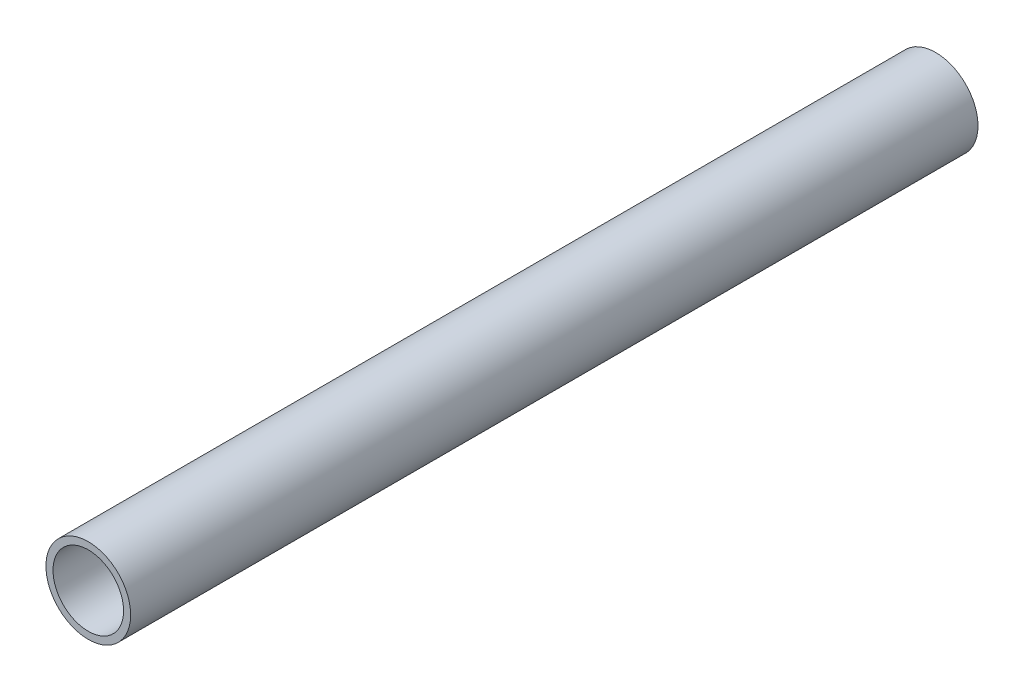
SolidWorks part; units mm, degrees
ref_plane "Plan de face" through (0, 0, 0) normal (0, 0, 1) x (1, 0, 0)
ref_plane "Plan de dessus" through (0, 0, 0) normal (0, 1, 0) x (1, 0, 0)
ref_plane "Plan de droite" through (0, 0, 0) normal (1, 0, 0) x (0, 0, -1)
sketch "Esquisse1" plane through (0, 0, 0) normal (0, 0, 1) x (1, 0, 0)
  circle A0 centre (0, 0) radius 25
  circle A1 centre (0, 0) radius 30
  dimension "D1" = 60
  dimension "D2" = 50
extrude "Extrusion1" add sketch "Esquisse1" along normal blind 600
